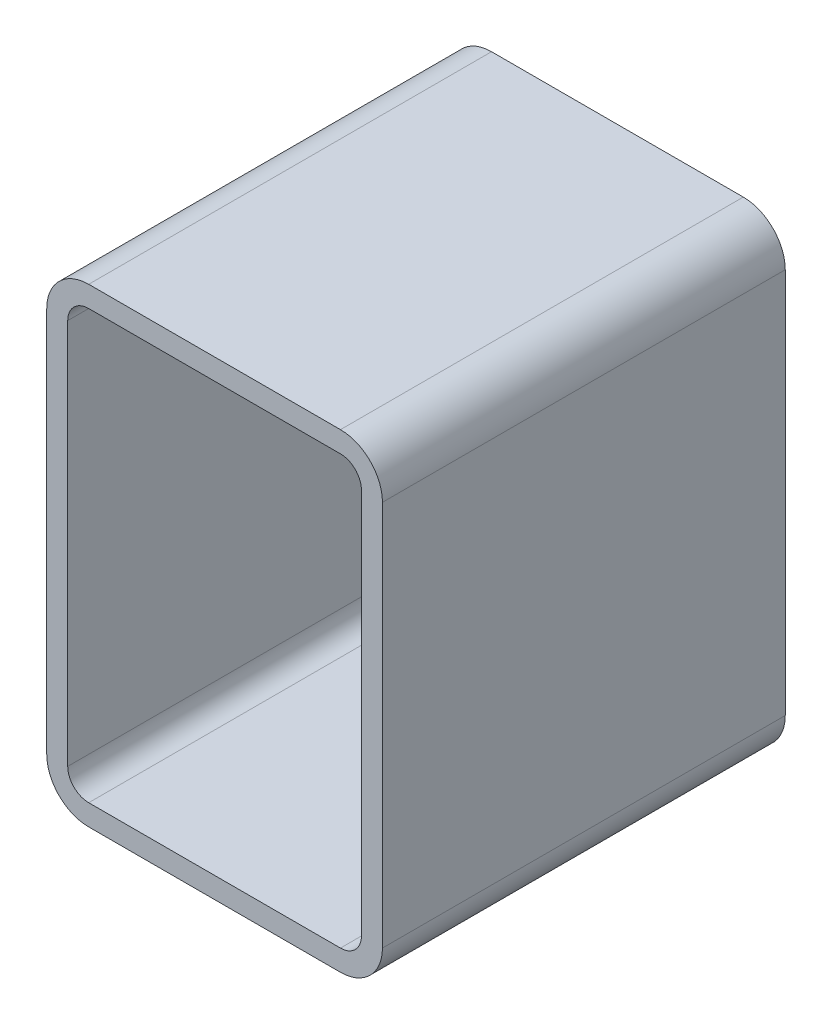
SolidWorks part; units mm, degrees
ref_plane "Front Plane" through (0, 0, 0) normal (0, 0, 1) x (1, 0, 0)
ref_plane "Top Plane" through (0, 0, 0) normal (0, 1, 0) x (1, 0, 0)
ref_plane "Right Plane" through (0, 0, 0) normal (1, 0, 0) x (0, 0, -1)
sketch "Sketch1" plane through (0, 0, 0) normal (0, 0, 1) x (1, 0, 0)
sketch_block_instance "HSS14x6x0.625-1"
sketch_block "HSS14x6x0.625"
extrude "Boss-Extrude1" add sketch "Sketch1" along normal blind 304.8
